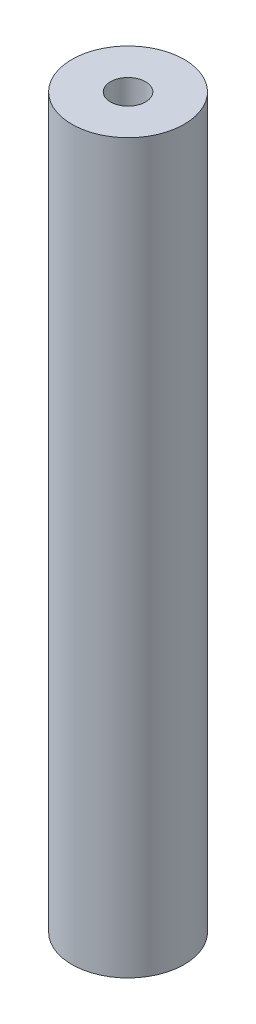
SolidWorks part; units mm, degrees
ref_plane "Front Plane" through (0, 0, 0) normal (0, 0, 1) x (1, 0, 0)
ref_plane "Top Plane" through (0, 0, 0) normal (0, 1, 0) x (1, 0, 0)
ref_plane "Right Plane" through (0, 0, 0) normal (1, 0, 0) x (0, 0, -1)
sketch "Sketch1" plane through (0, 0, 0) normal (0, 1, 0) x (1, 0, 0)
  circle A0 centre (0, 0) radius 4
  circle A1 centre (0, 0) radius 1.25
  dimension "D1" = 2.5
  dimension "D2" = 8
extrude "Boss-Extrude1" add sketch "Sketch1" along normal blind 51.8
sketch "Sketch2" plane through (0, 51.8, 0) normal (0, 1, 0) x (1, 0, 0)
  circle A0 centre (0, 0) radius 1.25 construction
  circle A1 centre (0, 0) radius 1.25
extrude "Boss-Extrude2" add sketch "Sketch2" against normal offset from surface (21.8 mm away) 15 from offset 15
